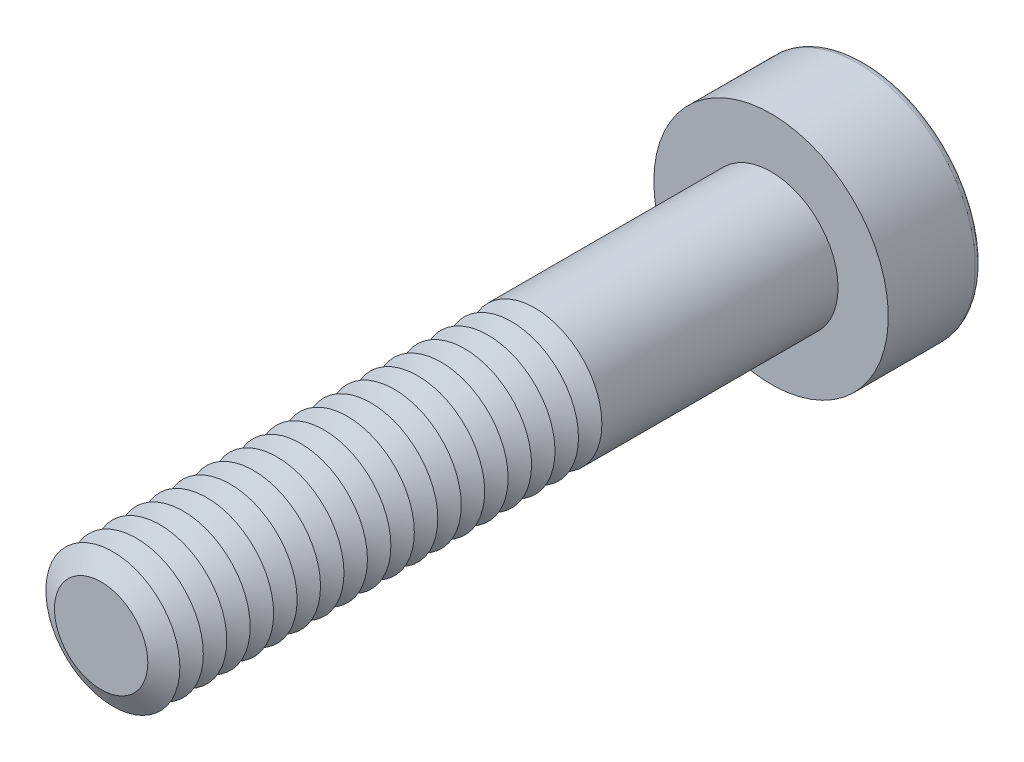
SolidWorks part; units mm, degrees
ref_plane "Front Plane" through (0, 0, 0) normal (0, 0, 1) x (1, 0, 0)
ref_plane "Top Plane" through (0, 0, 0) normal (0, 1, 0) x (1, 0, 0)
ref_plane "Right Plane" through (0, 0, 0) normal (1, 0, 0) x (0, 0, -1)
sketch "Sketch1" plane through (0, 0, 0) normal (0, 0, 1) x (1, 0, 0)
  circle A0 centre (0, 0) radius 2
  dimension "D1" = 4
extrude "Boss-Extrude1" add sketch "Sketch1" along normal blind 20
sketch "Sketch2" plane through (0, 0, 0) normal (0, 0, -1) x (-1, 0, 0)
  circle A0 centre (0, 0) radius 3.5
  dimension "D1" = 7
extrude "Boss-Extrude2" add sketch "Sketch2" along normal blind 2.8
sketch "Sketch3" plane through (0, 0, -2.8) normal (0, 0, -1) x (-1, 0, 0)
  line L1 (-0.7217, 1.25) -> (-1.4434, 0)
  line L2 (-1.4434, 0) -> (-0.7217, -1.25)
  line L3 (-0.7217, -1.25) -> (0.7217, -1.25)
  line L4 (0.7217, -1.25) -> (1.4434, 0)
  line L5 (1.4434, 0) -> (0.7217, 1.25)
  line L6 (0.7217, 1.25) -> (-0.7217, 1.25)
  circle A0 centre (0, 0) radius 1.25 construction
  dimension "D1" = 2.5
extrude "Cut-Extrude1" cut sketch "Sketch3" against normal blind 1.875
fillet "Fillet1" radius 0.2 1 edges at (-3.5, 0, -2.8)
sketch "Sketch4" plane through (0, 0, -0.925) normal (0, 0, -1) x (-1, 0, 0)
  line L0 (0.7217, -1.25) -> (1.4434, 0) construction
  circle A0 centre (0, 0) radius 1.25
extrude "Cut-Extrude2" cut sketch "Sketch4" against normal through all draft 60
sketch "Sketch5" plane through (0, 0, -2.8) normal (0, 0, -1) x (-1, 0, 0)
  circle A0 centre (0, 0) radius 1.4434
extrude "Cut-Extrude3" cut sketch "Sketch5" against normal through all draft 75
sketch "Sketch7" plane through (0, 0, 0) normal (1, 0, 0) x (0, 0, -1)
  line L25 (-20, 1.3938) -> (-19.65, 2)
  line L26 (-20, 2) -> (-20, -2) construction
  line L27 (-19.65, 2) -> (-20.35, 2)
  line L28 (-20.35, 2) -> (-20, 1.3938)
  line L29 (0, 2) -> (-20, 2) construction
  dimension "D1" = 0.7
revolve "Cut-Revolve1" cut sketch "Sketch7" angle 360 about axis through (0, 0, 20) along (0, 0, -1)
pattern_linear "LPattern1" count 19 spacing 0.7 along (0, 0, -1) of "Cut-Revolve1"
